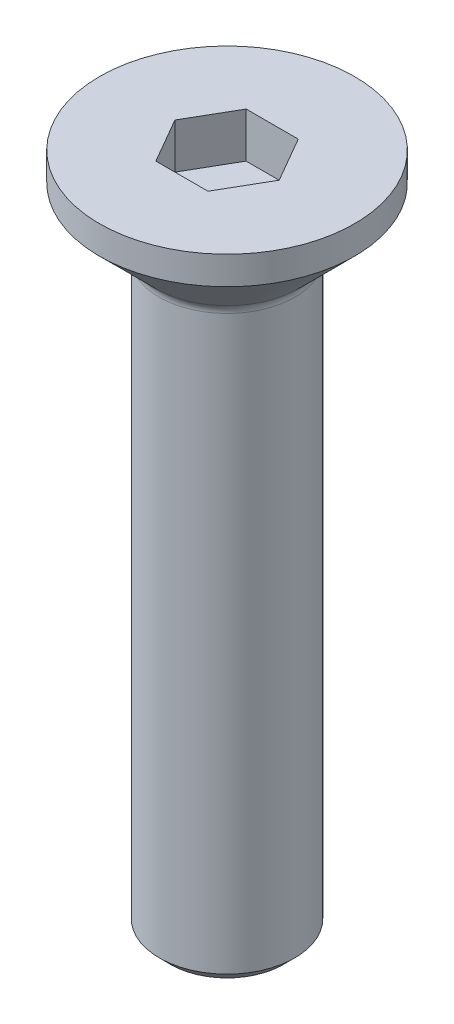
SolidWorks part; units mm, degrees
ref_plane "Plan1" through (0, 0, 0) normal (0, 0, 1) x (1, 0, 0)
ref_plane "Plan2" through (0, 0, 0) normal (0, 1, 0) x (1, 0, 0)
ref_plane "Plan3" through (0, 0, 0) normal (1, 0, 0) x (0, 0, -1)
sketch "Esquisse1" plane through (0, 0, 0) normal (0, 0, 1) x (1, 0, 0)
  line L0 (0, 0) -> (0, -30) construction
  line L1 (5.65, -1.25) -> (3.1757, -3.7243)
  line L2 (5.65, -1.25) -> (5.65, 0)
  line L3 (5.65, 0) -> (0, 0)
  line L4 (3, -4.1485) -> (3, -29.5)
  line L5 (2.5, -30) -> (0, -30)
  line L6 (3, -29.5) -> (2.5, -30)
  line L7 (0, 0) -> (0, -30)
  line L8 (3.1757, -3.7243) -> (3, -3.9) construction
  line L9 (3, -4.1485) -> (3, -3.9) construction
  arc A0 (3.1757, -3.7243) -> (3, -4.1485) centre (3.6, -4.1485) ccw
  point P12 (3, -30)
  dimension "C" = 0.6
  dimension "D1" = 11.3
  dimension "R" = 0.5
  dimension "D2" = 45
  dimension "D4" = 45
  dimension "L1" = 30
  dimension "H" = 3.9
  dimension "D" = 6
  dimension "H1" = 1.25
revolve "Révolution1" add sketch "Esquisse1" angle 360 about L0
sketch "Esquisse2" plane through (0, 0, 0) normal (0, 1, 0) x (1, 0, 0)
  line L1 (2.3094, 0) -> (1.1547, 2)
  line L2 (1.1547, 2) -> (-1.1547, 2)
  line L3 (-1.1547, 2) -> (-2.3094, 0)
  line L4 (-2.3094, 0) -> (-1.1547, -2)
  line L5 (-1.1547, -2) -> (1.1547, -2)
  line L6 (1.1547, -2) -> (2.3094, 0)
  circle A0 centre (0, 0) radius 2 construction
  dimension "S" = 4
extrude "Enlèv. mat.-Extru.1" cut sketch "Esquisse2" against normal blind 2
equation "\"R@Esquisse1\"=(\"D@Esquisse1\"-\"D2@Représentation de filetage1\")/2"
equation "\"C@Esquisse1\"=\"D@Esquisse1\"/10"
equation "\"Prof@Enlèv. mat.-Extru.1\"=\"D@Esquisse1\"/3"
